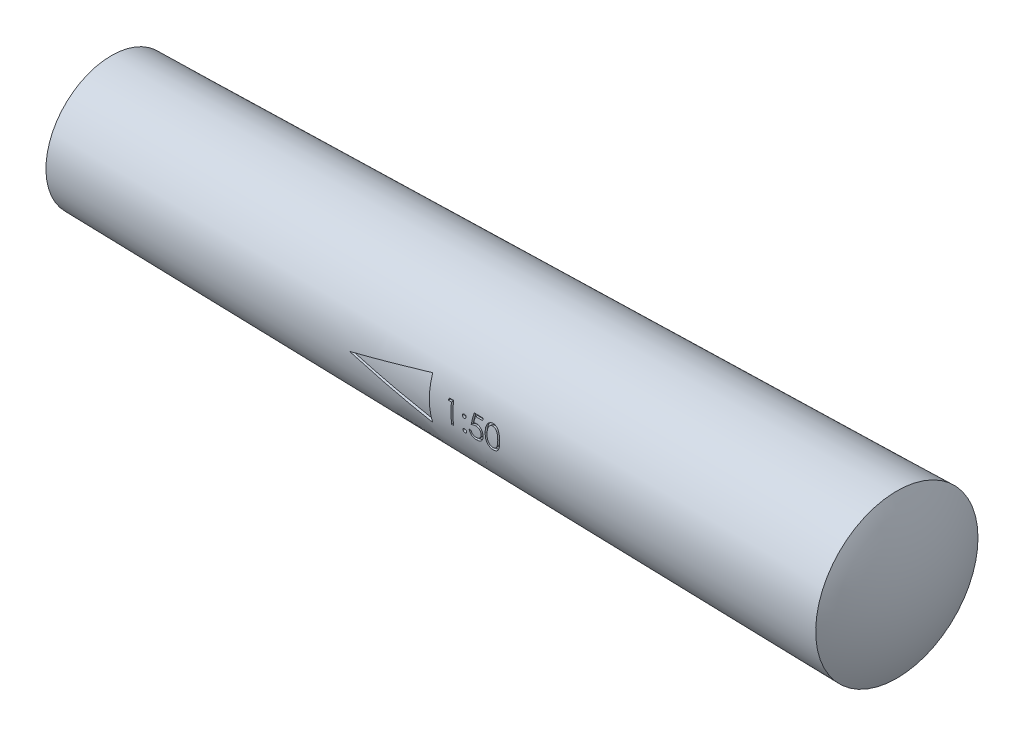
SolidWorks part; units mm, degrees
ref_plane "Front Plane" through (0, 0, 0) normal (0, 0, 1) x (1, 0, 0)
ref_plane "Top Plane" through (0, 0, 0) normal (0, 1, 0) x (1, 0, 0)
ref_plane "Right Plane" through (0, 0, 0) normal (1, 0, 0) x (0, 0, -1)
sketch "Sketch1" plane through (0, 0, 0) normal (1, 0, 0) x (0, 0, -1)
  circle A0 centre (0, 0) radius 3
  dimension "D1" = 6
extrude "Extrude1" add sketch "Sketch1" along normal mid plane 36
draft "Draft1" type of draft neutral plane draft angle 1.146 faces to draft 1 parameters "D1"=1.146
sketch "Sketch2" plane through (0, 0, 0) normal (0, 0, 1) x (1, 0, 0)
  line L0 (-18, 0) -> (-18, 3)
  line L1 (-18, 3) -> (-18, -3) construction
  line L2 (-18, 0) -> (-18.9, 0)
  line L3 (-18.9, 0) -> (-18.9, -3.36) construction
  line L4 (18, 0) -> (18, 3.72)
  line L5 (18, -3.72) -> (18, 3.72) construction
  line L6 (18, 0) -> (18.9, 0)
  line L7 (18.9, 0) -> (18.9, -3.36) construction
  line L8 (-18, -3) -> (18, -3.72) construction
  arc A0 (-18.9, 0) -> (-18, 3) centre (-13.45, 0) cw
  arc A1 (18.9, 0) -> (18, 3.72) centre (10.7619, 0) ccw
  point P14 (0, -3.36)
revolve "Revolve1" add sketch "Sketch2" angle 360 about L2
sketch "Sketch5" plane through (0, 0, 0) normal (0, 0, 1) x (1, 0, 0)
  line L0 (0, 3.36) -> (0, -3.36) construction
  line L1 (18, 3.72) -> (-18, 3) construction
  line L2 (-18, -3) -> (18, -3.72) construction
ref_plane "Plane2" through (0, 0, 0) normal (-0.02, 0, 0.9998) x (0.9998, 0, 0.02)
sketch "Sketch6" plane through (0, 0, 0) normal (-0.02, 0, 0.9998) x (0.9998, 0, 0.02)
  line L0 (0, 0) -> (0, 1)
  line L1 (0, 3.36) -> (0, -3.36) construction
  line L2 (0, 1) -> (-3.7321, 0)
  line L3 (-3.7321, 0) -> (0, -1)
  line L4 (0, -1) -> (0, 0)
  line L5 (0, -0.5) -> (4, -0.5) construction
  text T0 "1:50" font "Century Gothic" height 1
  dimension "D1" = 2
  dimension "D2" = 30
  dimension "D3" = 4
wrap "Wrap2" sketch "Sketch6" wrap type deboss source sketch "Sketch6" thickness 0.1 parameters "D1"=0.1
equation "\"D2@Sketch2\" = \"D1@Sketch2\""
